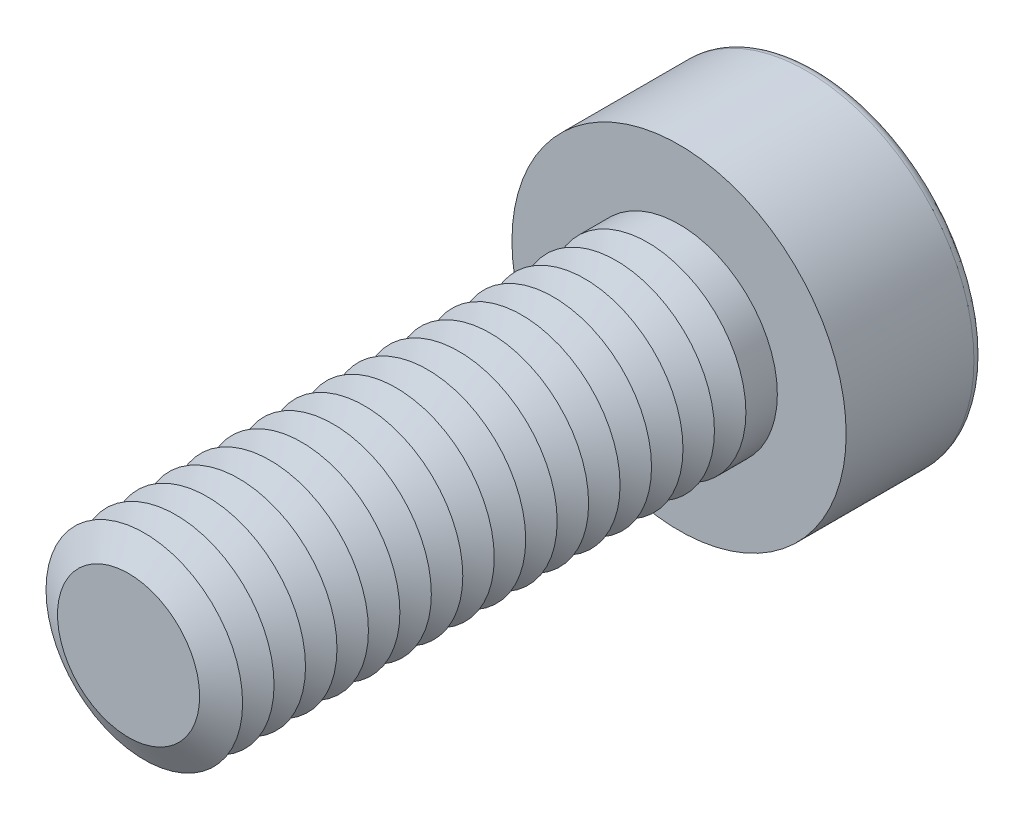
SolidWorks part; units mm, degrees
ref_plane "Front Plane" through (0, 0, 0) normal (0, 0, 1) x (1, 0, 0)
ref_plane "Top Plane" through (0, 0, 0) normal (0, 1, 0) x (1, 0, 0)
ref_plane "Right Plane" through (0, 0, 0) normal (1, 0, 0) x (0, 0, -1)
sketch "Sketch1" plane through (0, 0, 0) normal (0, 0, 1) x (1, 0, 0)
  circle A0 centre (0, 0) radius 2.5
  dimension "D1" = 5
extrude "Boss-Extrude1" add sketch "Sketch1" along normal blind 14
sketch "Sketch2" plane through (0, 0, 0) normal (0, 0, -1) x (-1, 0, 0)
  circle A0 centre (0, 0) radius 4.25
  dimension "D1" = 8.5
extrude "Boss-Extrude2" add sketch "Sketch2" along normal blind 3.5
sketch "Sketch3" plane through (0, 0, -3.5) normal (0, 0, -1) x (-1, 0, 0)
  line L1 (-0.866, 1.5) -> (-1.7321, 0)
  line L2 (-1.7321, 0) -> (-0.866, -1.5)
  line L3 (-0.866, -1.5) -> (0.866, -1.5)
  line L4 (0.866, -1.5) -> (1.7321, 0)
  line L5 (1.7321, 0) -> (0.866, 1.5)
  line L6 (0.866, 1.5) -> (-0.866, 1.5)
  circle A0 centre (0, 0) radius 1.5 construction
  dimension "D1" = 3
extrude "Cut-Extrude1" cut sketch "Sketch3" against normal blind 2.25
fillet "Fillet1" radius 0.25 1 edges at (-4.25, 0, -3.5)
sketch "Sketch4" plane through (0, 0, -1.25) normal (0, 0, -1) x (-1, 0, 0)
  line L0 (0.866, -1.5) -> (1.7321, 0) construction
  circle A0 centre (0, 0) radius 1.5
extrude "Cut-Extrude2" cut sketch "Sketch4" against normal through all draft 60
sketch "Sketch5" plane through (0, 0, -3.5) normal (0, 0, -1) x (-1, 0, 0)
  circle A0 centre (0, 0) radius 1.7321
extrude "Cut-Extrude3" cut sketch "Sketch5" against normal through all draft 75
sketch "Sketch7" plane through (0, 0, 0) normal (1, 0, 0) x (0, 0, -1)
  line L25 (-14, 1.8072) -> (-13.6, 2.5)
  line L26 (-14, 2.5) -> (-14, -2.5) construction
  line L27 (-13.6, 2.5) -> (-14.4, 2.5)
  line L28 (-14.4, 2.5) -> (-14, 1.8072)
  line L29 (0, 2.5) -> (-14, 2.5) construction
  dimension "D1" = 0.8
revolve "Cut-Revolve1" cut sketch "Sketch7" angle 360 about axis through (0, 0, 14) along (0, 0, -1)
pattern_linear "LPattern1" count 17 spacing 0.8 along (0, 0, -1) of "Cut-Revolve1"
